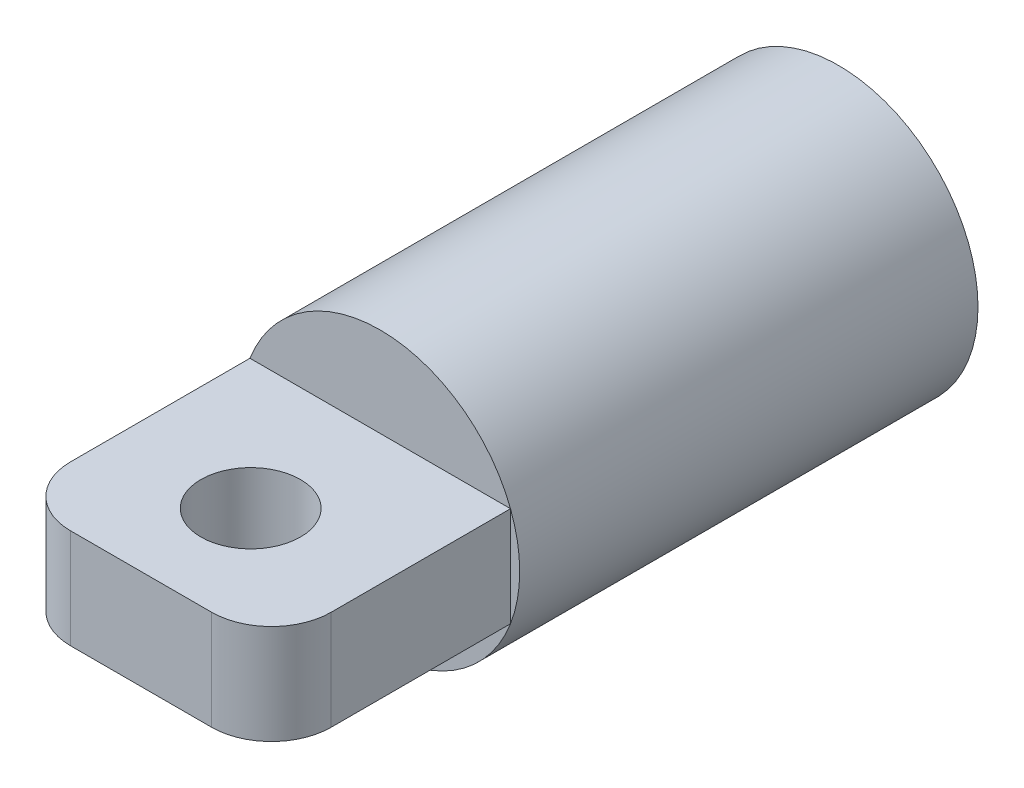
SolidWorks part; units mm, degrees
ref_plane "Front Plane" through (0, 0, 0) normal (0, 0, 1) x (1, 0, 0)
ref_plane "Top Plane" through (0, 0, 0) normal (0, 1, 0) x (1, 0, 0)
ref_plane "Right Plane" through (0, 0, 0) normal (1, 0, 0) x (0, 0, -1)
sketch "Sketch1" plane through (0, 0, 0) normal (0, 0, 1) x (1, 0, 0)
  circle A0 centre (0, 0) radius 7
  dimension "D1" = 14
extrude "Boss-Extrude1" add sketch "Sketch1" along normal blind 35
sketch "Sketch2" plane through (0, 0, 35) normal (0, 0, 1) x (1, 0, 0)
  line L1 (-6.5383, -2.5) -> (6.5383, -2.5)
  line L2 (-6.5383, -2.5) -> (-6.5383, 2.5)
  line L3 (-6.5383, 2.5) -> (6.5383, 2.5)
  line L4 (6.5383, -2.5) -> (6.5383, 2.5)
  line L5 (-6.5383, -2.5) -> (6.5383, 2.5) construction
  line L6 (-6.5383, 2.5) -> (6.5383, -2.5) construction
  circle A4 centre (0, 0) radius 7 construction
  point P0 (0, 0)
  dimension "D1" = 5
extrude "Cut-Extrude1" cut sketch "Sketch2" against normal blind 12 flip side to cut
fillet "Fillet2" radius 3 2 edges at (6.5383, 0, 35) (-6.5383, 0, 35)
sketch "Sketch4" plane through (0, -2.5, 0) normal (0, -1, 0) x (1, 0, 0)
  line L0 (-6.5383, 32) -> (0, 32) construction
  circle A0 centre (0, 29.5) radius 2.5
  dimension "D1" = 5
extrude "Cut-Extrude2" cut sketch "Sketch4" against normal blind 8
